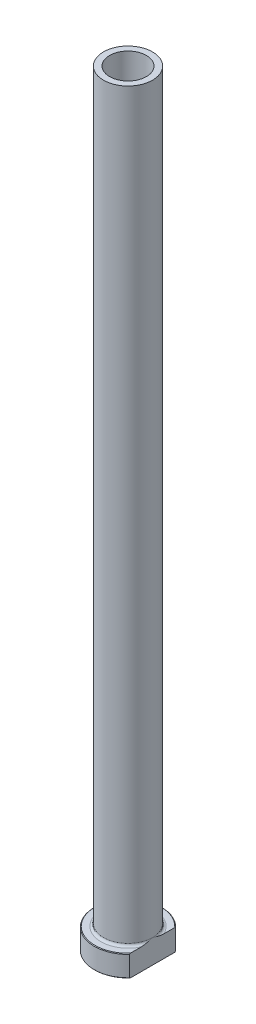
SolidWorks part; units mm, degrees
ref_plane "Front Plane" through (0, 0, 0) normal (0, 0, 1) x (1, 0, 0)
ref_plane "Top Plane" through (0, 0, 0) normal (0, 1, 0) x (1, 0, 0)
ref_plane "Right Plane" through (0, 0, 0) normal (1, 0, 0) x (0, 0, -1)
sketch "Sketch1" plane through (0, 0, 0) normal (0, 0, 1) x (1, 0, 0)
  line L0 (-6, 250) -> (-8, 250)
  line L1 (-8, 250) -> (-8, 7)
  line L2 (-8, 7) -> (-11, 7)
  line L3 (-11, 7) -> (-11, 0)
  line L4 (10.45, 0) -> (-10.45, 0) construction
  line L5 (-11, 0) -> (-6.25, 0)
  line L6 (-6, 195) -> (-6, 250)
  line L7 (0, 92.1877) -> (0, -15.5353) construction
  line L8 (0, -12.1) -> (0, 12.1) construction
  line L9 (-6, 195) -> (-6.25, 183)
  line L10 (-6.25, 183) -> (-6.25, 0)
  dimension "D1" = 0.25
  dimension "ID" = 12
  dimension "OD" = 16
  dimension "L" = 250
  dimension "H" = 22
  dimension "T" = 7
  dimension "N" = 55
  dimension "D2" = 12
  dimension "L-N" = 195
revolve "Revolve1" add sketch "Sketch1" angle 360 about L7
fillet "Fillet1" radius 0.8 1 edges at (0, 7, 8)
chamfer "Chamfer1" distance 0.2 angle 45 2 edges at (0, 7, 11) (0, 0, 11)
sketch "Sketch2" plane through (0, 0, 0) normal (0, -1, 0) x (1, 0, 0)
  line L0 (8, 7.5498) -> (8, -7.5498)
  circle A0 centre (0, 0) radius 11 construction
  arc A1 (8, 7.5498) -> (8, -7.5498) centre (0, 0) cw
  circle A2 centre (0, 0) radius 8 construction
extrude "Cut-Extrude1" cut sketch "Sketch2" against normal through all
chamfer "Chamfer2" distance 0.5 angle 45 1 edges at (0, 0, 6.25)
